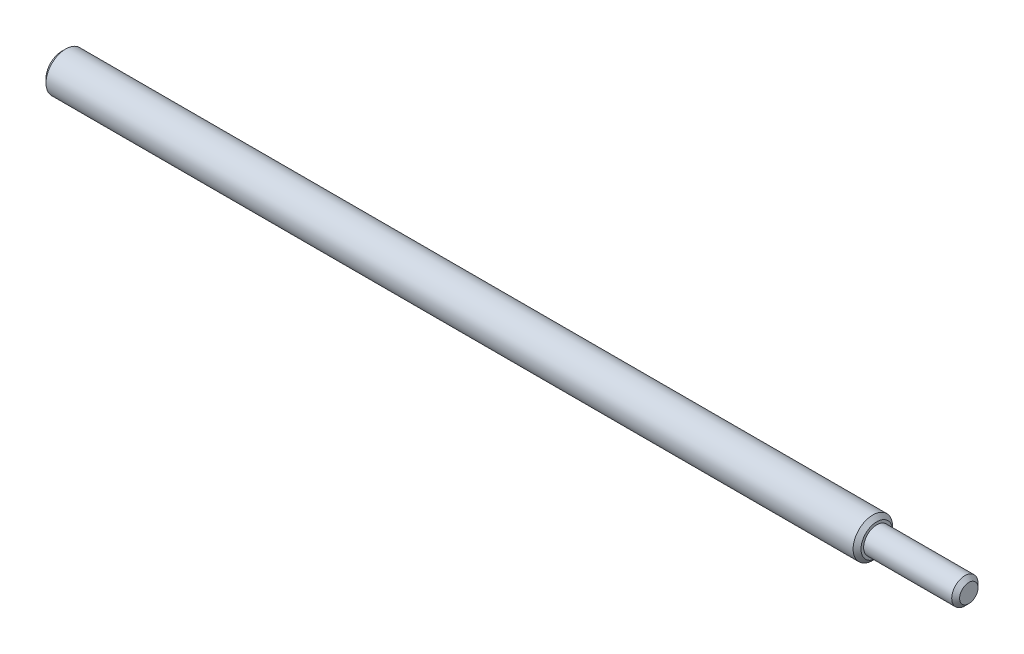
SolidWorks part; units mm, degrees
ref_plane "Plan de face" through (0, 0, 0) normal (0, 0, 1) x (1, 0, 0)
ref_plane "Plan de dessus" through (0, 0, 0) normal (0, 1, 0) x (1, 0, 0)
ref_plane "Plan de droite" through (0, 0, 0) normal (1, 0, 0) x (0, 0, -1)
sketch "Esquisse1" plane through (0, 0, 0) normal (0, 0, 1) x (1, 0, 0)
  line L0 (0, 0) -> (154.7924, 0) construction
  line L1 (0, 0) -> (0, 3)
  line L2 (0, 3) -> (124, 3)
  line L3 (124, 3) -> (124, 2)
  line L4 (124, 2) -> (138, 2)
  line L5 (138, 2) -> (138, 0)
  line L6 (0, 0) -> (138, 0)
  dimension "D1" = 4
  dimension "D2" = 6
  dimension "D3" = 124
  dimension "D4" = 14
revolve "Révolution1" add sketch "Esquisse1" angle 360 about L0
chamfer "Chanfrein1" distance 0.6 angle 45 3 edges at (124, 0, 3) (0, 0, 3) (138, 0, 2)
